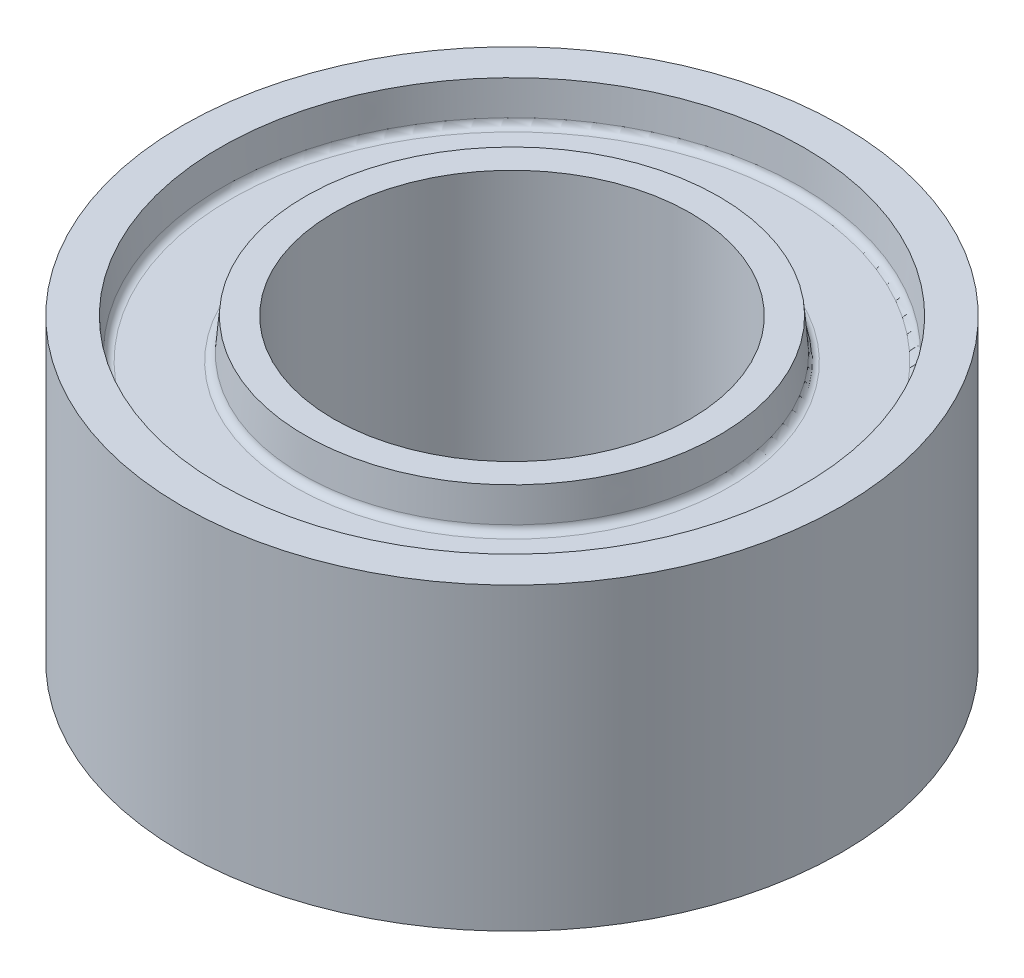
SolidWorks part; units mm, degrees
ref_plane "Front Plane" through (0, 0, 0) normal (0, 0, 1) x (1, 0, 0)
ref_plane "Top Plane" through (0, 0, 0) normal (0, 1, 0) x (1, 0, 0)
ref_plane "Right Plane" through (0, 0, 0) normal (1, 0, 0) x (0, 0, -1)
sketch "Sketch1" plane through (0, 0, 0) normal (0, 1, 0) x (1, 0, 0)
  line L7 (10.9949, 0.2812) -> (5.2539, 9.6625) construction
  line L8 (5.2539, 9.6625) -> (-5.741, 9.3813) construction
  line L9 (-5.741, 9.3813) -> (-10.9949, -0.2812) construction
  line L10 (-10.9949, -0.2812) -> (-5.2539, -9.6625) construction
  line L11 (-5.2539, -9.6625) -> (5.741, -9.3813) construction
  line L12 (5.741, -9.3813) -> (10.9949, 0.2812) construction
  circle A0 centre (0, 0) radius 9.525 construction
  circle A1 centre (0, 0) radius 10.9985
  circle A2 centre (0, 0) radius 5.9525
  dimension "D2" = 11.905
  dimension "D1" = 19.05
extrude "Boss-Extrude1" add sketch "Sketch1" along normal blind 10
ref_plane "Plane1" through (0, 10, 0) normal (-1, 0, 0) x (0, 0, 1)
sketch "Sketch2" plane through (0, 10, 0) normal (-1, 0, 0) x (0, 0, 1)
  line L0 (6.9977, -1.0889) -> (6.9024, 0)
  line L1 (6.9024, 0) -> (9.7346, 0)
  line L2 (9.7346, 0) -> (9.6393, -1.0889)
  line L3 (9.3863, -1.3208) -> (7.2507, -1.3208)
  line L4 (0, 50) -> (0, -50) construction
  arc A0 (9.6393, -1.0889) -> (9.3863, -1.3208) centre (9.3863, -1.0668) cw
  arc A1 (7.2507, -1.3208) -> (6.9977, -1.0889) centre (7.2507, -1.0668) cw
revolve "Groove for AS 568-015, O-Ring1" cut sketch "Sketch2"
